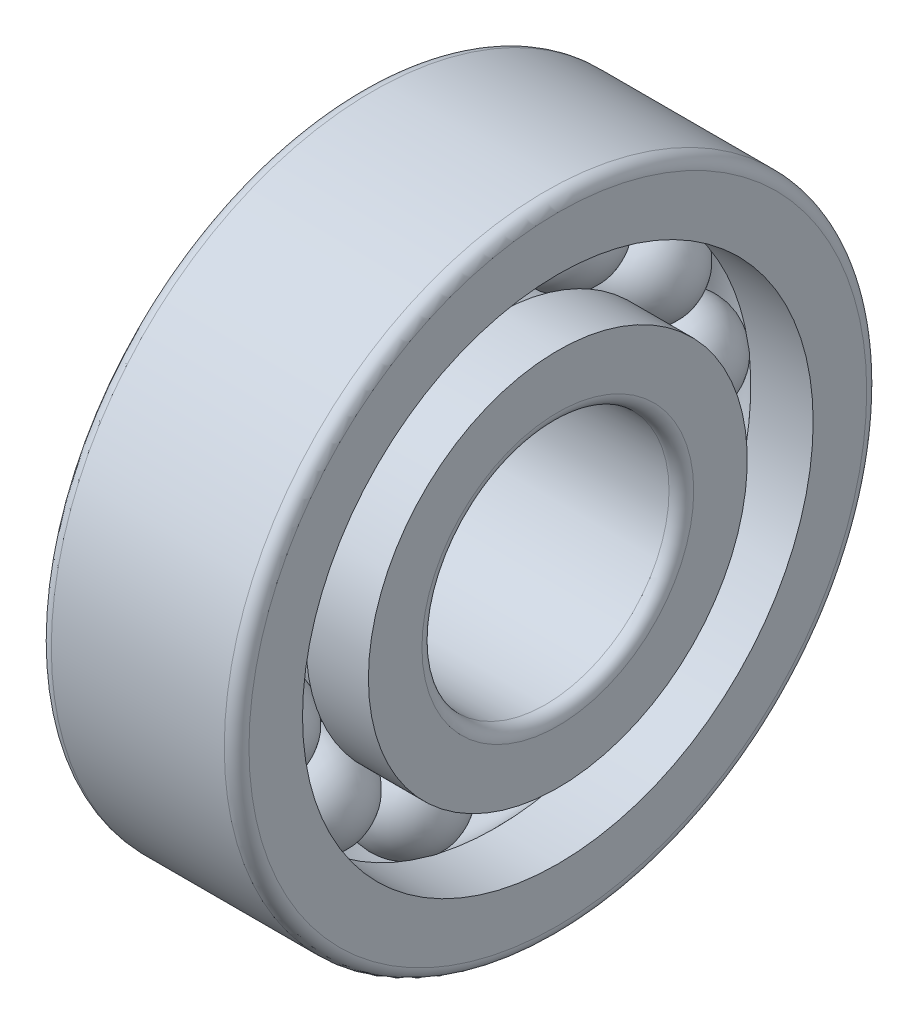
SolidWorks part; units mm, degrees
ref_plane "Front" through (0, 0, 0) normal (0, 0, 1) x (1, 0, 0)
ref_plane "Top" through (0, 0, 0) normal (0, 1, 0) x (1, 0, 0)
ref_plane "Right" through (0, 0, 0) normal (1, 0, 0) x (0, 0, -1)
sketch "Sketch1" plane through (0, 0, 0) normal (0, 0, 1) x (1, 0, 0)
  line L0 (-9.6833, 0) -> (9.8371, 0) construction
  line L1 (-2, 9) -> (2, 9)
  line L2 (-4.5966, 9) -> (4.6657, 9) construction
  arc A0 (2, 9) -> (-2, 9) centre (0, 9) ccw
  dimension "dia" = 4
  dimension "d0" = 18
revolve "Revolve1" add sketch "Sketch1" angle 360 about L2
sketch "Sketch2" plane through (0, 0, 0) normal (0, 0, 1) x (1, 0, 0)
  line L0 (-4, 7.6667) -> (-4, 5)
  line L1 (-4, 5) -> (4, 5)
  line L2 (4, 5) -> (4, 7.6667)
  line L3 (4, 7.6667) -> (1.4773, 7.6667)
  line L4 (-6.9714, 0) -> (8.1665, 0) construction
  line L5 (-6.7058, 9) -> (6.7058, 9) construction
  line L6 (-1.4773, 7.6667) -> (-4, 7.6667)
  arc A0 (-1.4773, 7.6667) -> (1.4773, 7.6667) centre (0, 9) ccw
  dimension "D5" = 3.98
  dimension "B" = 8
  dimension "B/2" = 4
  dimension "D3" = 9
  dimension "d" = 10
  dimension "D4" = 2.6667
revolve "Revolve2" add sketch "Sketch2" angle 360 about L4
sketch "Sketch3" plane through (0, 0, 0) normal (0, 0, 1) x (1, 0, 0)
  line L0 (-8.7107, 0) -> (9.1288, 0) construction
  line L1 (-4, 13) -> (4, 13)
  line L2 (-4, 13) -> (-4, 10.3333)
  line L3 (-4, 10.3333) -> (-1.4773, 10.3333)
  line L4 (4, 13) -> (4, 10.3333)
  line L5 (-7.2948, 9) -> (7.2948, 9) construction
  line L6 (1.4773, 10.3333) -> (4, 10.3333)
  arc A0 (1.4773, 10.3333) -> (-1.4773, 10.3333) centre (0, 9) ccw
  dimension "D1" = 3.98
  dimension "DD" = 26
  dimension "B" = 8
  dimension "B/2" = 4
  dimension "D4" = 9
  dimension "D5" = 2.6667
revolve "Revolve3" add sketch "Sketch3" angle 360 about L0
pattern_circular "Circular-Pattern1" count 13 over 360 about axis through (0, 0, 0) along (1, 0, 0) of "Revolve1"
fillet "Fillet1" radius 0.5 4 edges at (-4, 0, 5) (-4, 0, 13) (4, 0, 13) (4, 0, 5)
equation "\"d0@Sketch1\" = ( \"DD@Sketch3\" + \"d@Sketch2\" )  / 2"
equation "\"dia@Sketch1\" =  ( \"DD@Sketch3\" - \"d@Sketch2\" )  / 4"
equation "\"D3@Sketch2\" = ( \"DD@Sketch3\" + \"d@Sketch2\" )  / 2 / 2"
equation "\"D4@Sketch2\" = ( \"DD@Sketch3\" - \"d@Sketch2\" )  / 6"
equation "\"D5@Sketch2\" = \"dia@Sketch1\" - 0.02"
equation "\"B/2@Sketch2\" = \"B@Sketch2\" / 2"
equation "\"D4@Sketch3\" = ( \"DD@Sketch3\" + \"d@Sketch2\" )  / 2 / 2"
equation "\"D5@Sketch3\" = ( \"DD@Sketch3\" - \"d@Sketch2\" )  / 6"
equation "\"B@Sketch3\" = \"B@Sketch2\""
equation "\"B/2@Sketch3\" = \"B@Sketch3\" / 2"
equation "\"D1@Sketch3\" = \"dia@Sketch1\" - 0.02"
equation "\"m@Circular-Pattern1\" = int( 3.14159265 / atn(( \"dia@Sketch1\" / 2) / sqr(( \"DD@Sketch3\" + \"d@Sketch2\" )  / 2 * ( \"DD@Sketch3\" + \"d@Sketch2\" )  / 2/4 - ( \"dia@Sketch1\" / 2) *  ( \"dia@Sketch1\" / 2))))-1"
